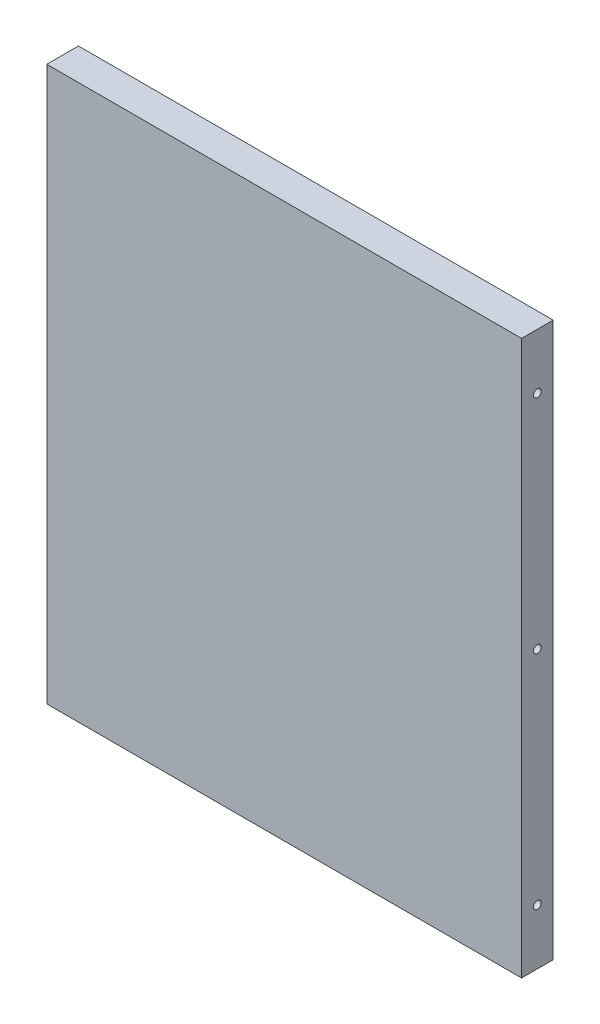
SolidWorks part; units mm, degrees
ref_plane "Ebene vorne" through (0, 0, 0) normal (0, 0, 1) x (1, 0, 0)
ref_plane "Ebene oben" through (0, 0, 0) normal (0, 1, 0) x (1, 0, 0)
ref_plane "Ebene rechts" through (0, 0, 0) normal (1, 0, 0) x (0, 0, -1)
sketch "Skizze1" plane through (0, 0, 0) normal (0, 0, 1) x (1, 0, 0)
  line L1 (-84.7009, 65.5769) -> (65.2991, 65.5769)
  line L2 (-84.7009, 65.5769) -> (-84.7009, -109.4231)
  line L3 (-84.7009, -109.4231) -> (65.2991, -109.4231)
  line L4 (65.2991, 65.5769) -> (65.2991, -109.4231)
  dimension "D1" = 150
  dimension "D2" = 175
extrude "Aufsatz-Linear austragen1" add sketch "Skizze1" along normal blind 10
sketch "Skizze2" plane through (-84.7009, 0, 0) normal (-1, 0, 0) x (0, 0, 1)
  line L0 (0, -21.9231) -> (10, -21.9231) construction
  line L1 (0, 65.5769) -> (0, -109.4231) construction
  line L2 (10, 65.5769) -> (10, -109.4231) construction
  line L3 (5, -91.9231) -> (5, -21.9231) construction
  line L4 (5, -21.9231) -> (5, 48.0769) construction
  circle A0 centre (5, 48.0769) radius 1.25
  circle A1 centre (5, -21.9231) radius 1.25
  circle A3 centre (5, -91.9231) radius 1.23
  point P11 (5, -21.9231)
  dimension "D2" = 2.5
  dimension "D3" = 2.46
  dimension "D1" = 70
extrude "Schnitt-Linear austragen1" cut sketch "Skizze2" against normal blind 5
sketch "Skizze3" plane through (65.2991, 0, 0) normal (1, 0, 0) x (0, 0, -1)
  line L0 (-10, -21.9231) -> (0, -21.9231) construction
  line L1 (-5, -91.9231) -> (-5, -21.9231) construction
  line L2 (-5, -21.9231) -> (-5, 48.0769) construction
  line L4 (0, -109.4231) -> (0, 65.5769) construction
  line L5 (-10, -109.4231) -> (-10, 65.5769) construction
  circle A0 centre (-5, 48.0769) radius 1.23
  circle A1 centre (-5, -21.9231) radius 1.23
  circle A3 centre (-5, -91.9231) radius 1.23
  point P7 (-5, -21.9231)
  dimension "D2" = 2.46
  dimension "D3" = 2.46
  dimension "D1" = 70
extrude "Schnitt-Linear austragen2" cut sketch "Skizze3" against normal blind 5
